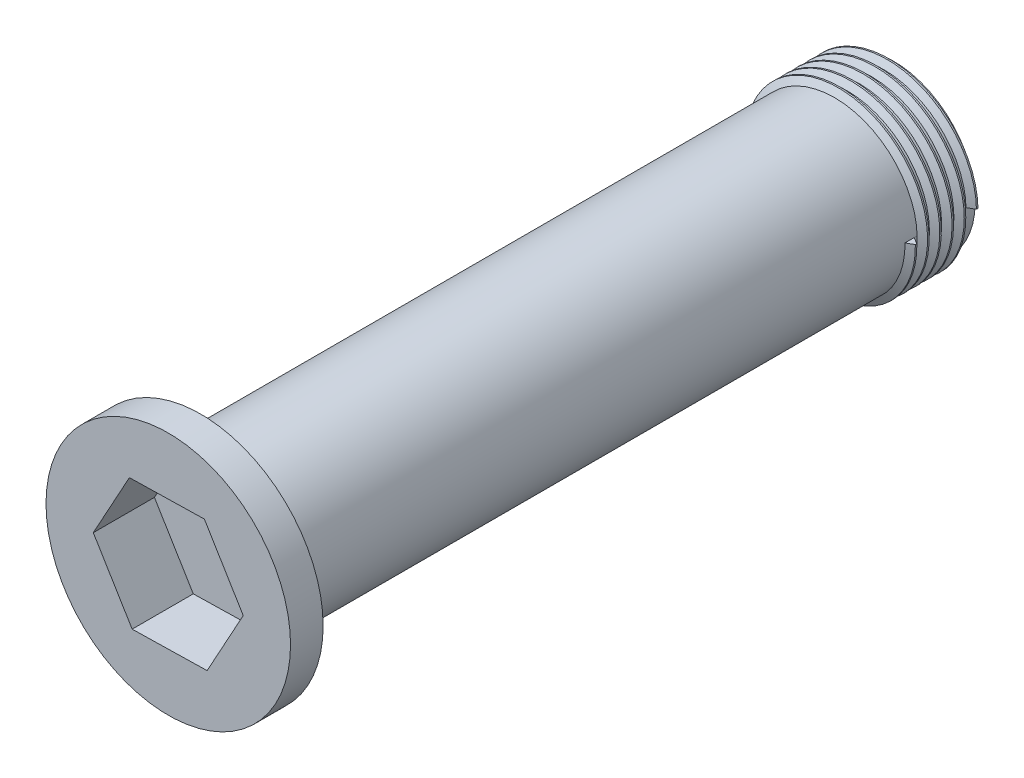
SolidWorks part; units mm, degrees
ref_plane "Alzado" through (0, 0, 0) normal (0, 0, 1) x (1, 0, 0)
ref_plane "Planta" through (0, 0, 0) normal (0, 1, 0) x (1, 0, 0)
ref_plane "Vista lateral" through (0, 0, 0) normal (1, 0, 0) x (0, 0, -1)
ref_plane "Plano1" through (0, 0, 51.9) normal (0, 0, 1) x (1, 0, 0)
sketch "Sk_Cana" plane through (0, 0, 51.9) normal (0, 0, 1) x (1, 0, 0)
  circle A0 centre (0, 0) radius 2
extrude "Cana" add sketch "Sk_Cana" along normal blind 17
ref_plane "Plano2" through (0, 0, 68.9) normal (0, 0, 1) x (1, 0, 0)
sketch "Sk_Cabeza" plane through (0, 0, 68.9) normal (0, 0, 1) x (1, 0, 0)
  circle A0 centre (0, 0) radius 3
extrude "Cabeza" add sketch "Sk_Cabeza" along normal blind 0.8
sketch "Croquis1" plane through (0, 0, 51.9) normal (0, 0, -1) x (-1, 0, 0)
  circle A1 centre (0, 0) radius 2
  circle A2 centre (0, 0) radius 2
  dimension "D1" = 0
thread "Rosca1" pitch 0.3 start angle 0, offset 0, length 0, pitch 0.3, diameter 4
ref_plane "Plano4" through (2, 0, 51.9) normal (0, -1, 0) x (1, 0, 0)
sketch "Perfil de rosca2" plane through (2, 0, 51.9) normal (0, -1, 0) x (1, 0, 0)
  line L0 (0, 0) -> (0, 0.3) construction
  line L1 (0, 0) -> (0.1624, 0.0937)
  line L2 (0.1624, 0.0937) -> (0.1624, 0.1312)
  line L3 (0.1624, 0.1312) -> (0, 0.225)
  line L4 (0.1624, 0.1125) -> (0, 0.1125) construction
  line L11 (0, 0) -> (0, 0.225)
  point P2 (0, 0)
  dimension "Pitch" = 0.3
  dimension "Profile_Angle" = 60
  dimension "Profile_Land" = 0.0375
  dimension "Profile_Height" = 0.1624
sketch "Croquis9" plane through (0, 0, 69.7) normal (0, 0, 1) x (1, 0, 0)
  line L1 (0.886, 1.6125) -> (-0.9535, 1.5735)
  line L2 (-0.9535, 1.5735) -> (-1.8395, -0.039)
  line L3 (-1.8395, -0.039) -> (-0.886, -1.6125)
  line L4 (-0.886, -1.6125) -> (0.9535, -1.5735)
  line L5 (0.9535, -1.5735) -> (1.8395, 0.039)
  line L6 (1.8395, 0.039) -> (0.886, 1.6125)
  circle A0 centre (0, 0) radius 1.5934 construction
extrude "Cortar-Extruir1" cut sketch "Croquis9" against normal blind 1.5
